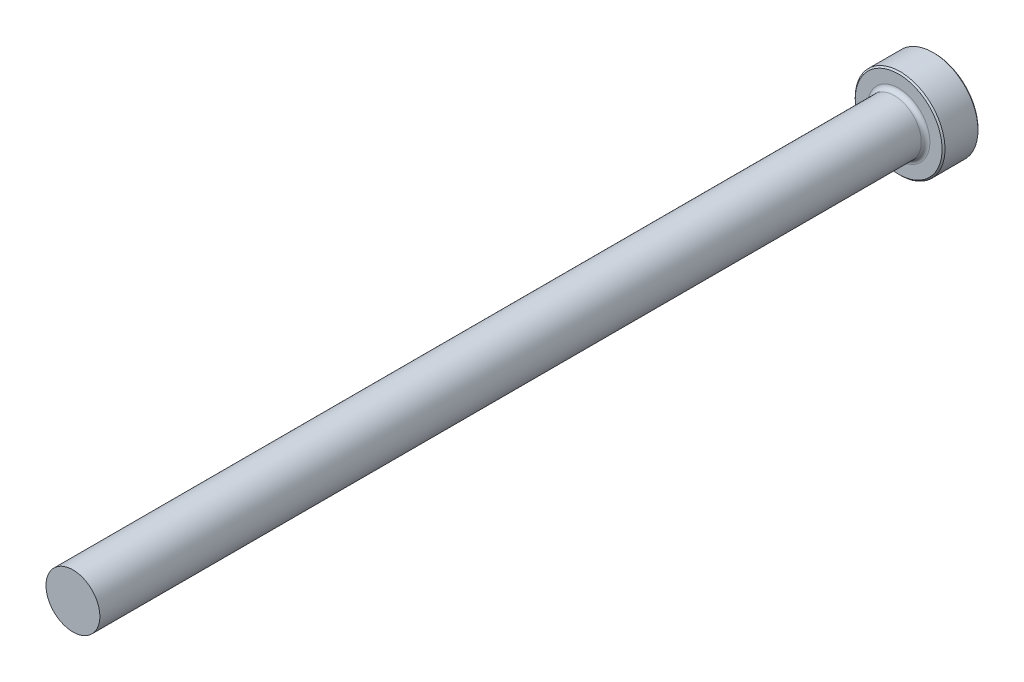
SolidWorks part; units mm, degrees
ref_plane "Front Plane" through (0, 0, 0) normal (0, 0, 1) x (1, 0, 0)
ref_plane "Top Plane" through (0, 0, 0) normal (0, 1, 0) x (1, 0, 0)
ref_plane "Right Plane" through (0, 0, 0) normal (1, 0, 0) x (0, 0, -1)
sketch "Sketch2" plane through (0, 0, 0) normal (1, 0, 0) x (0, 0, 1)
  line L0 (-2.1475, 0) -> (290.2977, 0) construction
  line L1 (152.4, 0) -> (0, 0)
  line L2 (0, 0) -> (0, 7.9375)
  line L3 (0, 7.9375) -> (6.35, 7.9375)
  line L5 (6.35, 7.9375) -> (6.35, 5.5245)
  line L7 (7.112, 4.7625) -> (152.4, 4.7625)
  line L8 (152.4, 0) -> (152.4, 4.7625)
  arc A0 (7.112, 4.7625) -> (6.35, 5.5245) centre (7.112, 5.5245) cw
  dimension "D5" = 0.762
  dimension "D1" = 15.875
  dimension "D2" = 6.35
  dimension "D3" = 9.525
  dimension "D4" = 152.4
revolve "Revolve1" add sketch "Sketch2" angle 360 about L0
chamfer "Chamfer1" distance 0.254 angle 45 2 edges at (-7.9375, 0, 0) (-7.9375, 0, 6.35)
